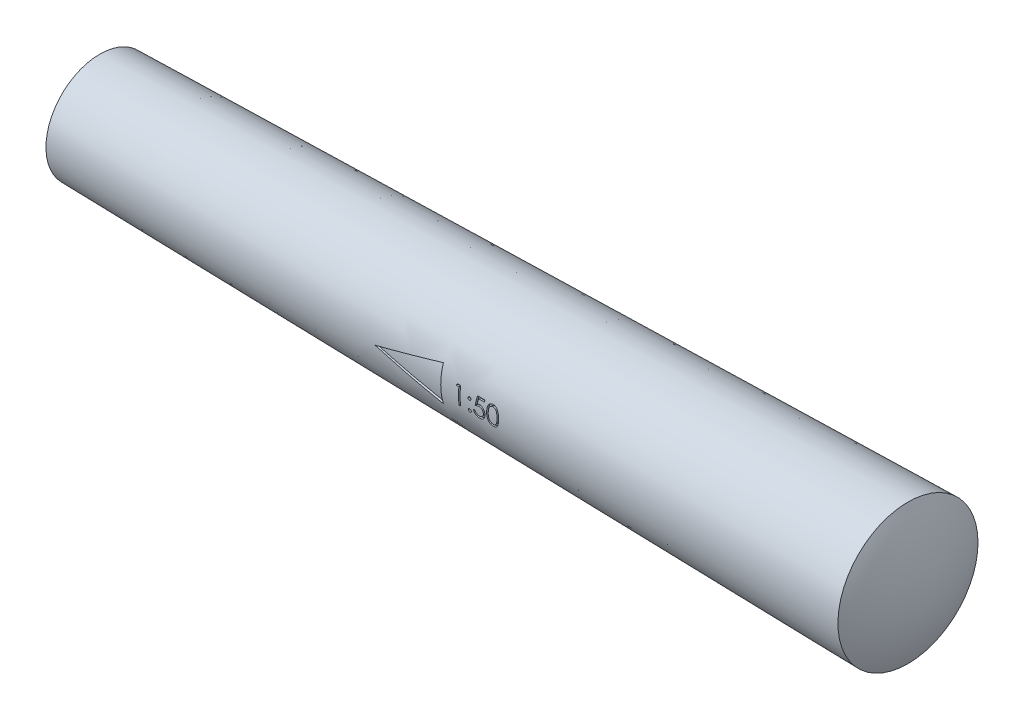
SolidWorks part; units mm, degrees
ref_plane "Front Plane" through (0, 0, 0) normal (0, 0, 1) x (1, 0, 0)
ref_plane "Top Plane" through (0, 0, 0) normal (0, 1, 0) x (1, 0, 0)
ref_plane "Right Plane" through (0, 0, 0) normal (1, 0, 0) x (0, 0, -1)
sketch "Sketch1" plane through (0, 0, 0) normal (1, 0, 0) x (0, 0, -1)
  circle A0 centre (0, 0) radius 3
  dimension "D1" = 6
extrude "Extrude1" add sketch "Sketch1" along normal mid plane 45
draft "Draft1" type of draft neutral plane draft angle 1.146 faces to draft 1 parameters "D1"=1.146
sketch "Sketch2" plane through (0, 0, 0) normal (0, 0, 1) x (1, 0, 0)
  line L0 (-22.5, 0) -> (-22.5, 3)
  line L1 (-22.5, 3) -> (-22.5, -3) construction
  line L2 (-22.5, 0) -> (-23.4, 0)
  line L3 (-23.4, 0) -> (-23.4, -3.45) construction
  line L4 (22.5, 0) -> (22.5, 3.9)
  line L5 (22.5, -3.9) -> (22.5, 3.9) construction
  line L6 (22.5, 0) -> (23.4, 0)
  line L7 (23.4, 0) -> (23.4, -3.45) construction
  line L8 (-22.5, -3) -> (22.5, -3.9) construction
  arc A0 (-23.4, 0) -> (-22.5, 3) centre (-17.95, 0) cw
  arc A1 (23.4, 0) -> (22.5, 3.9) centre (14.4999, 0) ccw
  point P14 (0, -3.45)
revolve "Revolve1" add sketch "Sketch2" angle 360 about L2
sketch "Sketch5" plane through (0, 0, 0) normal (0, 0, 1) x (1, 0, 0)
  line L0 (0, 3.45) -> (0, -3.45) construction
  line L1 (22.5, 3.9) -> (-22.5, 3) construction
  line L2 (-22.5, -3) -> (22.5, -3.9) construction
ref_plane "Plane2" through (0, 0, 0) normal (-0.02, 0, 0.9998) x (0.9998, 0, 0.02)
sketch "Sketch6" plane through (0, 0, 0) normal (-0.02, 0, 0.9998) x (0.9998, 0, 0.02)
  line L0 (0, 0) -> (0, 1)
  line L1 (0, 3.45) -> (0, -3.45) construction
  line L2 (0, 1) -> (-3.7321, 0)
  line L3 (-3.7321, 0) -> (0, -1)
  line L4 (0, -1) -> (0, 0)
  line L5 (0, -0.5) -> (4, -0.5) construction
  text T0 "1:50" font "Century Gothic" height 1
  dimension "D1" = 2
  dimension "D2" = 30
  dimension "D3" = 4
wrap "Wrap2" sketch "Sketch6" wrap type deboss source sketch "Sketch6" thickness 0.1 parameters "D1"=0.1
equation "\"D2@Sketch2\" = \"D1@Sketch2\""
